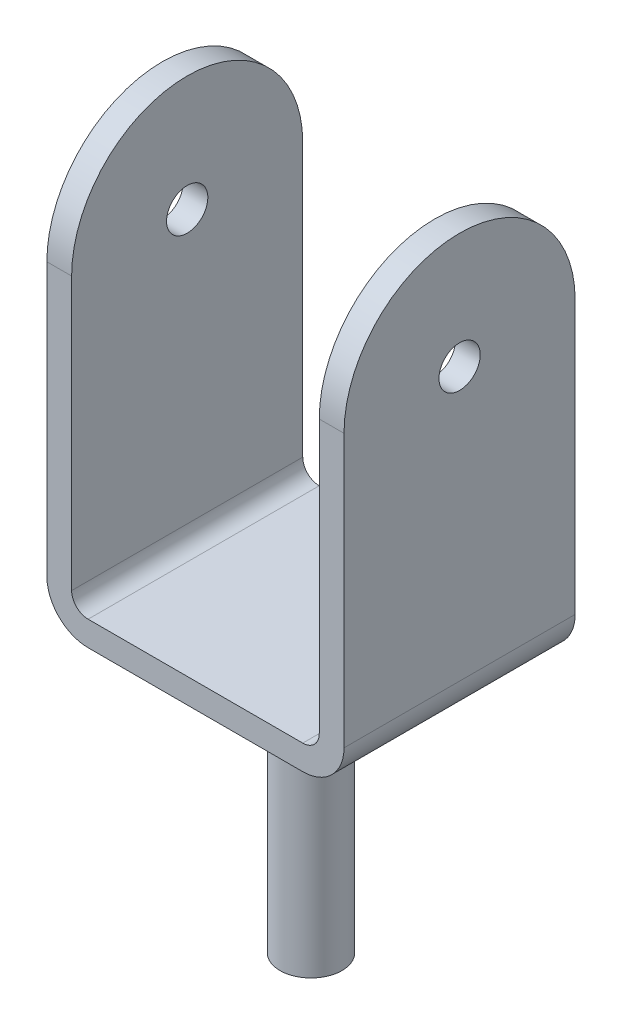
SolidWorks part; units mm, degrees
ref_plane "Front Plane" through (0, 0, 0) normal (0, 0, 1) x (1, 0, 0)
ref_plane "Top Plane" through (0, 0, 0) normal (0, 1, 0) x (1, 0, 0)
ref_plane "Right Plane" through (0, 0, 0) normal (1, 0, 0) x (0, 0, -1)
sketch "Sketch1" plane through (0, 0, 0) normal (0, 0, 1) x (1, 0, 0)
  line L0 (-180, 0) -> (180, 0)
  line L1 (180, 0) -> (180, 520)
  line L2 (0, 0) -> (0, 275.5265) construction
  line L3 (-180, 0) -> (-180, 520)
  line L4 (150, 30) -> (150, 520)
  line L5 (-150, 30) -> (150, 30)
  line L6 (-150, 30) -> (-150, 520)
  line L7 (-180, 520) -> (-150, 520)
  line L8 (150, 520) -> (180, 520)
  dimension "D1" = 180
  dimension "D2" = 520
  dimension "D3" = 30
extrude "Boss-Extrude1" add sketch "Sketch1" along normal mid plane 280
fillet "Fillet1" radius 20 2 edges at (150, 30, 0) (-150, 30, 0)
fillet "Fillet2" radius 50 2 edges at (180, 0, 0) (-180, 0, 0)
sketch "Sketch2" plane through (-180, 0, 0) normal (-1, 0, 0) x (0, 0, 1)
  line L0 (-140, 520) -> (-140, 50) construction
  line L1 (140, 520) -> (-140, 520) construction
  line L2 (-140, 380) -> (140, 380) construction
  line L6 (-140, 380) -> (-175, 380)
  line L7 (-175, 380) -> (-175, 580)
  line L8 (-175, 580) -> (175, 580)
  line L9 (175, 580) -> (175, 380)
  line L10 (175, 380) -> (140, 380)
  arc A0 (140, 380) -> (-140, 380) centre (0, 380) ccw
  point P13 (-175.579, 580)
  dimension "D1" = 280
  dimension "D2" = 200
  dimension "D3" = 350
extrude "Cut-Extrude2" cut sketch "Sketch2" against normal up to surface (360 mm away)
sketch "Sketch4" plane through (-180, 0, 0) normal (-1, 0, 0) x (0, 0, 1)
  line L0 (-140, 380) -> (140, 380) construction
  arc A0 (140, 380) -> (-140, 380) centre (0, 380) ccw construction
  circle A1 centre (0, 380) radius 25
  dimension "D1" = 50
extrude "Cut-Extrude3" cut sketch "Sketch4" against normal up to surface (360 mm away)
sketch "Sketch5" plane through (0, 0, 0) normal (0, -1, 0) x (1, 0, 0)
  circle A0 centre (0, 0) radius 37.5
  dimension "D1" = 75
extrude "Boss-Extrude2" add sketch "Sketch5" along normal blind 325
